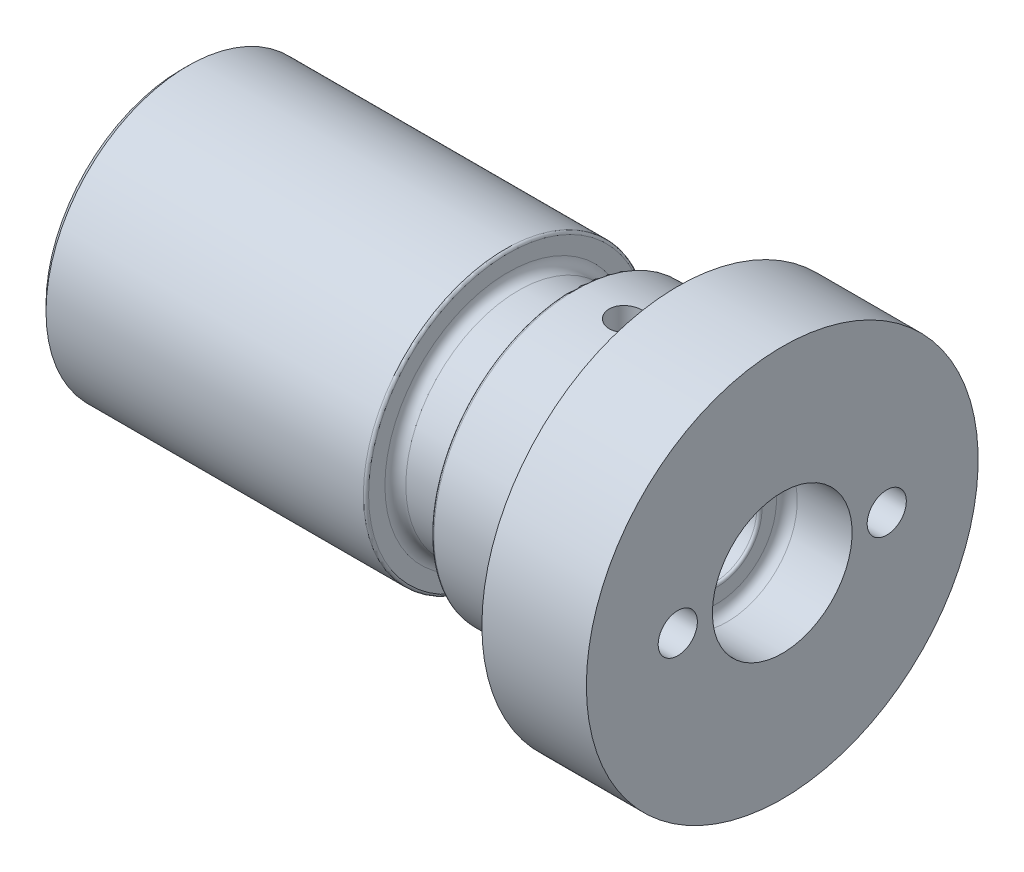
SolidWorks part; units mm, degrees
ref_plane "Plane1" through (0, 0, 0) normal (0, 0, 1) x (1, 0, 0)
ref_plane "Plane2" through (0, 0, 0) normal (0, 1, 0) x (1, 0, 0)
ref_plane "Plane3" through (0, 0, 0) normal (1, 0, 0) x (0, 0, -1)
sketch "Sketch1" plane through (0, 0, 0) normal (0, 0, 1) x (1, 0, 0)
  line L0 (0, 0) -> (60, 0) construction
  line L1 (41, 3.25) -> (31.5, 3.25)
  line L3 (41, 3.25) -> (41, 5.35)
  line L4 (31.5, 3.25) -> (31.5, 6)
  line L6 (0, 6) -> (0, 10.875)
  line L7 (41, 5.35) -> (46, 5.35)
  line L10 (25, 8.625) -> (30, 8.625)
  line L13 (25, 10.875) -> (25, 8.625)
  line L15 (30, 8.625) -> (30, 10.875)
  line L16 (30, 10.875) -> (38, 10.875)
  line L22 (0, 10.875) -> (25, 10.875)
  line L23 (38, 10.875) -> (38, 15)
  line L24 (38, 15) -> (46, 15)
  line L25 (46, 15) -> (46, 5.35)
  line L26 (31.5, 6) -> (0, 6)
  dimension "D2" = 10.7
  dimension "D3" = 6.5
  dimension "D4" = 5
  dimension "D5" = 8
  dimension "D6" = 17.25
  dimension "D7" = 5
  dimension "D8" = 25
  dimension "D11" = 21.75
  dimension "D12" = 8
  dimension "D13" = 30
  dimension "D14" = 12
  dimension "D15" = 31.5
revolve "Base-Revolve" add sketch "Sketch1" angle 360 about L0
chamfer "Chamfer1" distance 0.5 angle 45 1 edges at (0, 0, 10.875)
ref_plane "Plane4" through (0, 11.125, 0) normal (0, 1, 0) x (-1, 0, 0)
hole_wizard "M3 Tapped Hole1" positions "Sketch6" profile "Sketch5" tap size "M3" standard "ISO"
sketch "Sketch6" plane through (0, 11.125, 0) normal (0, 1, 0) x (-1, 0, 0)
  line L0 (0, 0) -> (-60, 0) construction
  line L1 (-38, -15) -> (-38, 15) construction
  point P0 (-34, 0)
  dimension "D1" = 4
sketch "Sketch5" plane through (34, 11.125, 0) normal (1, 0, 0) x (0, 0, 1)
  line L0 (0, 0) -> (0, 7.2511)
  line L1 (0, 7.2511) -> (1.25, 6.5)
  line L2 (1.25, 6.5) -> (1.25, 0)
  line L5 (1.25, 0) -> (0, 0)
  line L10 (0, 7.2511) -> (-1.25, 6.5) construction
  line L11 (0, -6.35) -> (0, 107.95) construction
  dimension "Tap Drill Dia." = 2.5
  dimension "Tap Drill Depth" = 6.5
  dimension "Drill Angle" = 118
fillet "Fillet1" radius 0.8 2 edges at (30, 0, 8.625) (25, 0, 8.625)
hole_wizard "M3x0.5 Tapped Hole1" positions "Sketch8" profile "Sketch7" tap size "M3x0.5" standard "Ansi Metric"
sketch "Sketch8" plane through (46, 0, 0) normal (1, 0, 0) x (0, 0, -1)
  line L1 (50, 0) -> (-50, 0) construction
  point P0 (8, 0)
  dimension "D1" = 8
sketch "Sketch7" plane through (46, 0, -8) normal (0, 1, 0) x (0, 0, -1)
  line L0 (0, 0) -> (0, 9.9013)
  line L1 (0, 9.9013) -> (1.5, 9)
  line L2 (1.5, 9) -> (1.5, 0)
  line L5 (1.5, 0) -> (0, 0)
  line L10 (0, 9.9013) -> (-1.5, 9) construction
  line L11 (0, -6.35) -> (0, 107.95) construction
  dimension "Tap Drill Dia." = 3
  dimension "Tap Drill Depth" = 9
  dimension "Drill Angle" = 118
pattern_circular "CirPattern1" count 2 over 360 about axis through (0, 0, 0) along (1, 0, 0) of "M3 Tapped Hole1"
pattern_circular "CirPattern2" count 2 over 360 about axis through (0, 0, 0) along (1, 0, 0) of "M3x0.5 Tapped Hole1"
fillet "Fillet3" radius 0.8 1 edges at (41, 0, 5.35)
sketch "Sketch9" plane through (0, 0, 0) normal (-1, 0, 0) x (0, 0, 1)
  line L0 (0, 7.55) -> (0, 0) construction
  line L1 (-1.525, 7.55) -> (1.525, 7.55)
  line L2 (-1.525, 7.55) -> (-1.525, 3.5)
  line L3 (-1.525, 3.5) -> (1.525, 3.5)
  line L4 (1.525, 7.55) -> (1.525, 3.5)
  dimension "D1" = 7.55
  dimension "D2" = 3.05
  dimension "D3" = 3.5
extrude "Cut-Extrude1" cut sketch "Sketch9" against normal blind 23
fillet "Fillet5" [suppressed] radius 1.5
hole_wizard "M3.0 (3.000000) Diameter Hole3" positions "Sketch13" profile "Sketch12" hole size "M3.0" standard "Ansi Metric"
sketch "Sketch13" plane through (46, 0, 0) normal (1, 0, 0) x (0, 0, -1)
  line L0 (0, 11) -> (0, 0) construction
  point P0 (0, 11)
  dimension "D1" = 11
sketch "Sketch12" plane through (46, 11, 0) normal (0, 1, 0) x (0, 0, -1)
  line L0 (0, 0) -> (0, 6.9013)
  line L1 (0, 6.9013) -> (1.5, 6)
  line L2 (1.5, 6) -> (1.5, 0)
  line L5 (1.5, 0) -> (0, 0)
  line L10 (0, 6.9013) -> (-1.5, 6) construction
  line L11 (0, -6.35) -> (0, 107.95) construction
  dimension "Hole Dia." = 3
  dimension "Hole Depth" = 6
  dimension "Drill Angle" = 118
pattern_circular "CirPattern3" [suppressed] count 4 over 360 about axis through (0, 0, 0) along (1, 0, 0)
sketch "Sketch14" plane through (0, 0, 0) normal (0, 0, 1) x (1, 0, 0)
  line L1 (-4.8871, 16.366) -> (47.9702, 16.366)
  line L2 (-4.8871, 16.366) -> (-4.8871, -16.9162)
  line L3 (-4.8871, -16.9162) -> (47.9702, -16.9162)
  line L4 (47.9702, 16.366) -> (47.9702, -16.9162)
extrude "Cut-Extrude2" [suppressed] cut sketch "Sketch14" against normal blind 17
fillet "Fillet2" radius 0.2 3 edges at (30, 0, 10.875) (25, 0, 10.875) (41, 0, 3.25)
